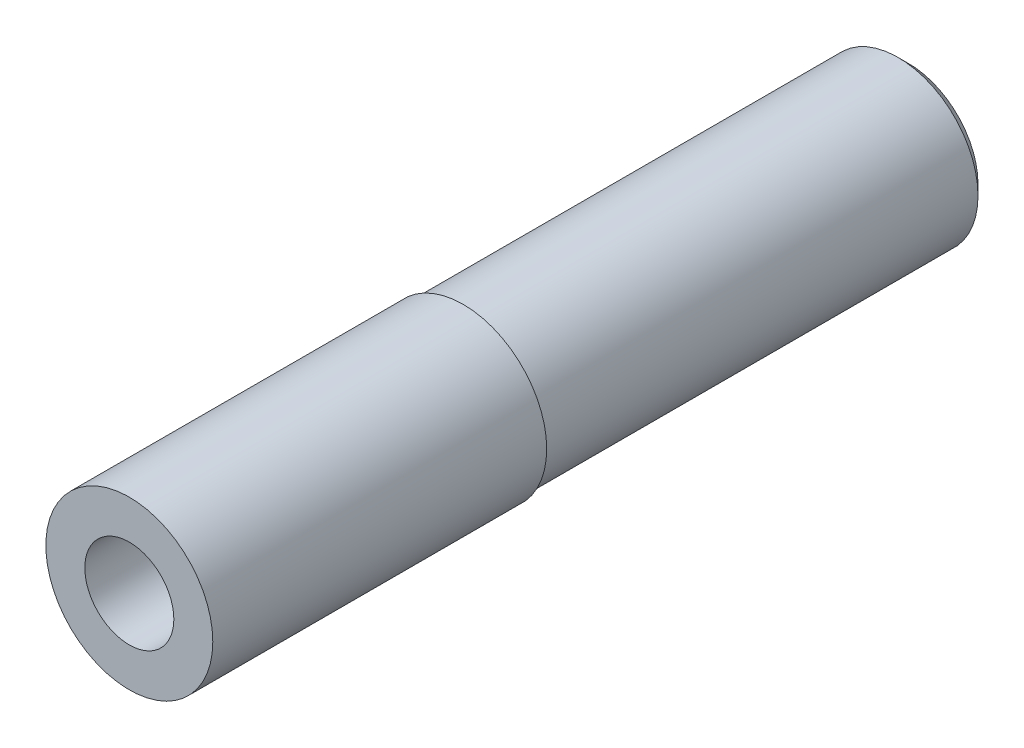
SolidWorks part; units mm, degrees
ref_plane "Front Plane" through (0, 0, 0) normal (0, 0, 1) x (1, 0, 0)
ref_plane "Top Plane" through (0, 0, 0) normal (0, 1, 0) x (1, 0, 0)
ref_plane "Right Plane" through (0, 0, 0) normal (1, 0, 0) x (0, 0, -1)
sketch "Sketch1" plane through (0, 0, 0) normal (1, 0, 0) x (0, 0, -1)
  line L2 (0, 1.5) -> (0, 0.8)
  line L3 (13.75, 1.5) -> (0, 1.5)
  line L4 (-3.7979, 0) -> (49996.2021, 0) construction
  line L8 (11, 0.6) -> (2.2, 0.6)
  line L9 (2.2, 0.8) -> (2.2, 0.6)
  line L10 (2.2, 0.8) -> (0, 0.8)
  line L12 (14, 1) -> (14, 1.25)
  line L16 (14, 1.25) -> (13.75, 1.5)
  line L17 (14, 1) -> (11, 1)
  line L18 (11, 0.6) -> (11, 1)
  dimension "D1" = 14
  dimension "D2" = 45
  dimension "D3" = 0.25
  dimension "D4" = 3
  dimension "D5" = 1.6
  dimension "D6" = 2.2
  dimension "D7" = 1.2
  dimension "D8" = 2
  dimension "D9" = 3
revolve "Revolve1" add sketch "Sketch1" angle 360 about L4
sketch "Sketch5" plane through (0, 0, 0) normal (1, 0, 0) x (0, 0, -1)
  line L0 (0, 0) -> (50000, 0) construction
  line L1 (0, 1.5) -> (0, -1.5) construction
  line L2 (6, 1.435) -> (14, 1.435)
  line L3 (6, 1.435) -> (6, 2.435)
  line L4 (6, 2.435) -> (14, 2.435)
  line L5 (14, 1.435) -> (14, 2.435)
  line L6 (14, -1.25) -> (14, 1.25) construction
  line L7 (13.75, 1.5) -> (0, 1.5) construction
  dimension "D1" = 6
  dimension "D2" = 0.065
  dimension "D3" = 1
revolve "Cut-Revolve1" cut sketch "Sketch5" angle 360 about L0
sketch "Sketch3" plane through (0, 0, -2.2) normal (0, 0, 1) x (1, 0, 0)
  line L0 (0, 0) -> (0, 50000) construction
  line L1 (0.3464, 0.6) -> (-0.3464, 0.6)
  line L2 (-0.3464, 0.6) -> (-0.6928, 0)
  line L3 (-0.6928, 0) -> (-0.3464, -0.6)
  line L4 (-0.3464, -0.6) -> (0.3464, -0.6)
  line L5 (0.3464, -0.6) -> (0.6928, 0)
  line L6 (0.6928, 0) -> (0.3464, 0.6)
  line L7 (0, 0) -> (50000, 0) construction
  circle A0 centre (0, 0) radius 0.6 construction
  circle A1 centre (0, 0) radius 0.6 construction
extrude "Cut-Extrude2" cut sketch "Sketch3" against normal blind 1.4
